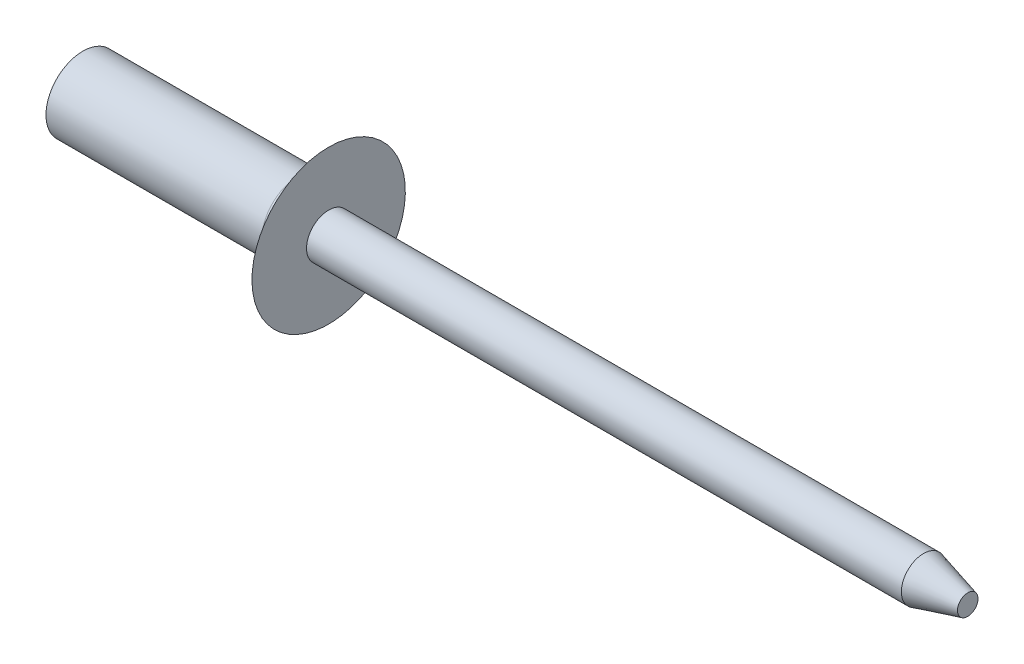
SolidWorks part; units mm, degrees
ref_plane "Front" through (0, 0, 0) normal (0, 0, 1) x (1, 0, 0)
ref_plane "Top" through (0, 0, 0) normal (0, 1, 0) x (1, 0, 0)
ref_plane "Right" through (0, 0, 0) normal (1, 0, 0) x (0, 0, -1)
sketch "Sketch1" plane through (-20.7953, 23.9153, 0) normal (0, 0, 1) x (0, -1, 0)
  line L0 (23.9153, 20.7953) -> (25.4153, 20.7953)
  line L1 (25.4153, 20.7953) -> (25.4153, 29.86)
  line L2 (25.4153, 29.86) -> (27.0353, 30.7953)
  line L3 (27.0353, 30.7953) -> (24.8153, 30.7953)
  line L4 (24.8153, 30.7953) -> (24.8153, 56.7953)
  line L5 (23.9153, 51.1695) -> (23.9153, -6.4589) construction
  line L6 (24.8153, 56.7953) -> (23.9153, 56.7953)
  line L7 (23.9153, 56.7953) -> (23.9153, 20.7953)
  dimension "l" = 10
  dimension "d" = 3
  dimension "dk" = 6.24
  dimension "d1" = 1.8
  dimension "D5" = 60
  dimension "l1" = 26
revolve "Base-Revolve" add sketch "Sketch1" angle 360 about L5
fillet "Fillet1" radius 0.5 1 edges at (9.0647, 1.5, 0)
chamfer "Chamfer1" distance 1.8 angle 15 1 edges at (36, 0.9, 0)
equation "\"D1@Chamfer1\" = \"d1@Sketch1\""
